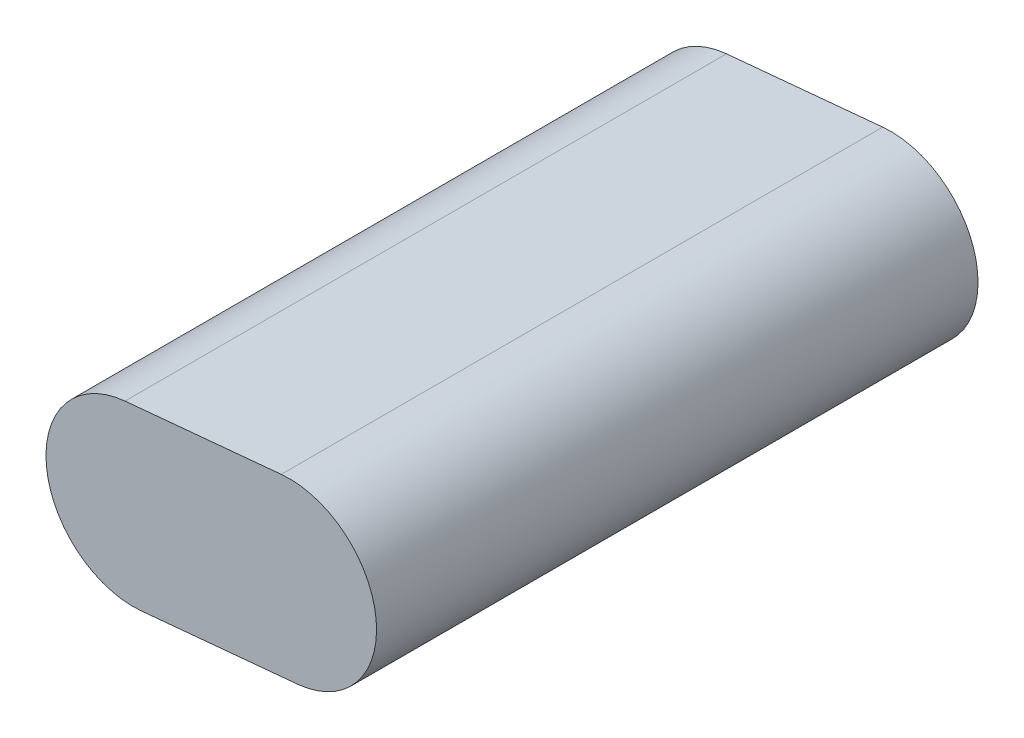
SolidWorks part; units mm, degrees
ref_plane "Front Plane" through (0, 0, 0) normal (0, 0, 1) x (1, 0, 0)
ref_plane "Top Plane" through (0, 0, 0) normal (0, 1, 0) x (1, 0, 0)
ref_plane "Right Plane" through (0, 0, 0) normal (1, 0, 0) x (0, 0, -1)
sketch "Sketch1" plane through (0, 0, 0) normal (0, 0, 1) x (1, 0, 0)
  line L0 (-0.8405, 8.9607) -> (17.0809, 10.6416)
  line L1 (0.8405, -8.9607) -> (18.7618, -7.2797)
  line L2 (0.9339, -9.9563) -> (18.8552, -8.2754)
  line L3 (-0.9339, 9.9563) -> (16.9875, 11.6372)
  circle A0 centre (17.9213, 1.6809) radius 9 construction
  circle A1 centre (0, 0) radius 9 construction
  arc A2 (18.7618, -7.2797) -> (17.0809, 10.6416) centre (17.9213, 1.6809) ccw
  arc A3 (-0.8405, 8.9607) -> (0.8405, -8.9607) centre (0, 0) ccw
  arc A4 (-0.9339, 9.9563) -> (0.9339, -9.9563) centre (0, 0) ccw
  arc A5 (18.8552, -8.2754) -> (16.9875, 11.6372) centre (17.9213, 1.6809) ccw
  point P10 (19.6165, -7.158)
  point P11 (0, 0)
  point P12 (0, 0)
  point P13 (0, 0)
  point P14 (0, 0)
  point P15 (20.4087, -9.3652)
  point P16 (0, 0)
  point P17 (1.4488, -10.622)
  point P18 (-1.4268, -15.6567)
  point P19 (0, 0)
  point P20 (0, 0)
  dimension "D1" = 1
extrude "Boss-Extrude1" add sketch "Sketch1" against normal up to surface (65 mm away)
sketch "Sketch2" plane through (0, 0, -65) normal (0, 0, -1) x (-1, 0, 0)
  line L0 (0.9339, 9.9563) -> (-16.9875, 11.6372) construction
  line L1 (-18.8552, -8.2754) -> (-0.9339, -9.9563) construction
  line L2 (0.9339, 9.9563) -> (-16.9875, 11.6372)
  line L3 (-18.8552, -8.2754) -> (-0.9339, -9.9563)
  arc A0 (-16.9875, 11.6372) -> (-18.8552, -8.2754) centre (-17.9213, 1.6809) ccw construction
  arc A1 (-0.9339, -9.9563) -> (0.9339, 9.9563) centre (0, 0) ccw construction
  arc A2 (-16.9875, 11.6372) -> (-18.8552, -8.2754) centre (-17.9213, 1.6809) ccw
  arc A3 (-0.9339, -9.9563) -> (0.9339, 9.9563) centre (0, 0) ccw
extrude "Boss-Extrude2" add sketch "Sketch2" along normal blind 2
sketch "Sketch3" plane through (0, 0, 0) normal (0, 0, 1) x (1, 0, 0)
  line L2 (0.9339, -9.9563) -> (18.8552, -8.2754)
  line L3 (16.9875, 11.6372) -> (-0.9339, 9.9563)
  line L4 (0.9339, -9.9563) -> (18.8552, -8.2754)
  line L5 (16.9875, 11.6372) -> (-0.9339, 9.9563)
  arc A2 (-0.9339, 9.9563) -> (0.9339, -9.9563) centre (0, 0) ccw
  arc A3 (18.8552, -8.2754) -> (16.9875, 11.6372) centre (17.9213, 1.6809) ccw
  arc A4 (-0.9339, 9.9563) -> (0.9339, -9.9563) centre (0, 0) ccw
  arc A5 (18.8552, -8.2754) -> (16.9875, 11.6372) centre (17.9213, 1.6809) ccw
  dimension "D1" = 0
extrude "Boss-Extrude3" add sketch "Sketch3" along normal blind 2
